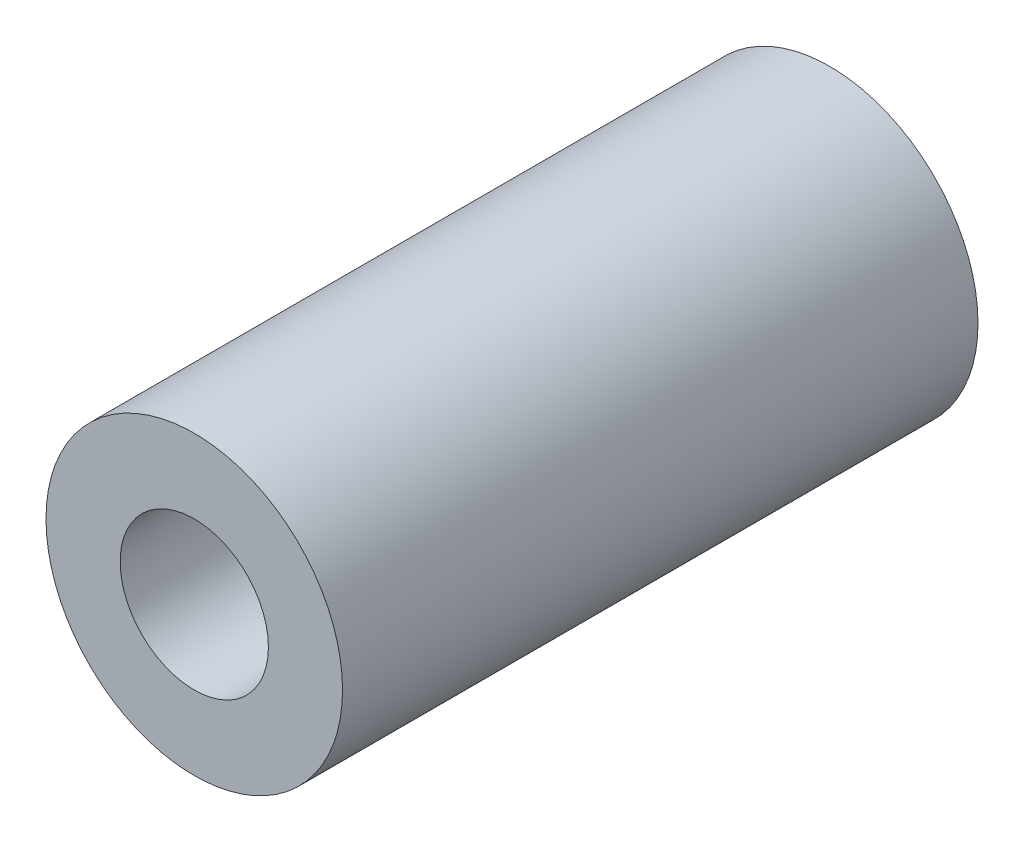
SolidWorks part; units mm, degrees
ref_plane "Plan de face" through (0, 0, 0) normal (0, 0, 1) x (1, 0, 0)
ref_plane "Plan de dessus" through (0, 0, 0) normal (0, 1, 0) x (1, 0, 0)
ref_plane "Plan de droite" through (0, 0, 0) normal (1, 0, 0) x (0, 0, -1)
sketch "Esquisse1" plane through (0, 0, 0) normal (0, 0, 1) x (1, 0, 0)
  circle A0 centre (0, 0) radius 3.5
  circle A1 centre (0, 0) radius 1.75
  dimension "D1" = 7
  dimension "D2" = 3.5
extrude "Extrusion1" add sketch "Esquisse1" against normal blind 15
